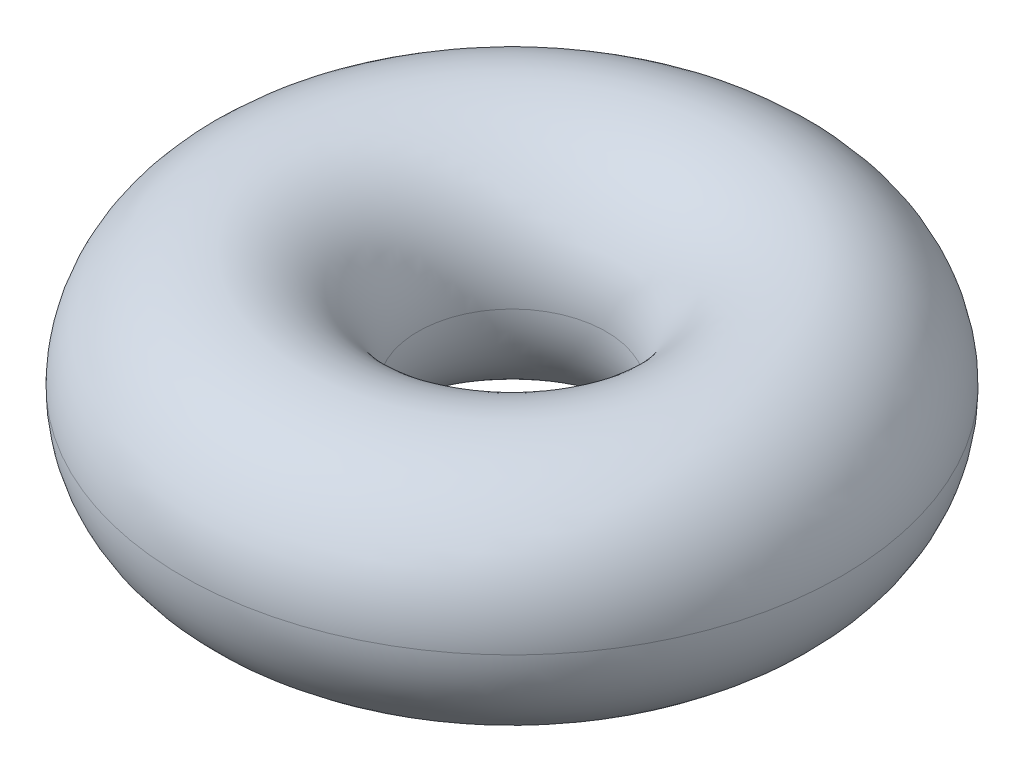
SolidWorks part; units mm, degrees
ref_plane "Front Plane" through (0, 0, 0) normal (0, 0, 1) x (1, 0, 0)
ref_plane "Top Plane" through (0, 0, 0) normal (0, 1, 0) x (1, 0, 0)
ref_plane "Right Plane" through (0, 0, 0) normal (1, 0, 0) x (0, 0, -1)
sketch "Sketch1" plane through (0, 0, 0) normal (0, 0, 1) x (1, 0, 0)
  line L0 (0, 0) -> (0, 26.8474) construction
  circle A0 centre (22.5, 0) radius 12.5
  dimension "D1" = 25
  dimension "D2" = 70
revolve "Revolve1" add sketch "Sketch1" angle 360 about L0
sketch "Sketch2" plane through (0, 0, 0) normal (0, 0, 1) x (1, 0, 0)
  line L0 (-35, 0) -> (35, 0)
  arc A0 (-22.5, 12.5) -> (-22.5, -12.5) centre (-22.5, 0) ccw construction
  arc A1 (22.5, -12.5) -> (22.5, 12.5) centre (22.5, 0) ccw construction
